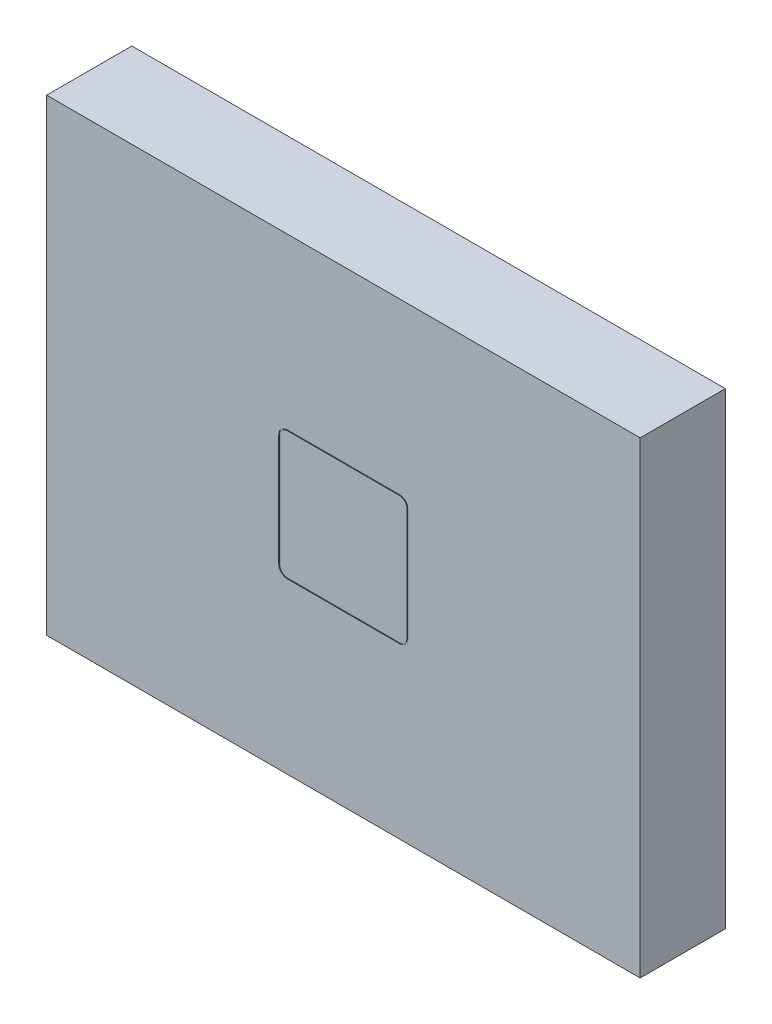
SolidWorks part; units mm, degrees
ref_plane "Front Plane" through (0, 0, 0) normal (1, 0, 0) x (0, 1, 0)
ref_plane "Top Plane" through (0, 0, 0) normal (0, 0, 1) x (0, 1, 0)
ref_plane "Right Plane" through (0, 0, 0) normal (0, 1, 0) x (-1, 0, 0)
sketch "Sketch1" plane through (0, 0, 0) normal (0, 0, 1) x (0, 1, 0)
  line L1 (-33500, 42500) -> (33500, 42500)
  line L2 (-33500, 42500) -> (-33500, -42500)
  line L3 (-33500, -42500) -> (33500, -42500)
  line L4 (33500, 42500) -> (33500, -42500)
  line L5 (-33500, 42500) -> (33500, -42500) construction
  line L6 (-33500, -42500) -> (33500, 42500) construction
  point P0 (0, 0)
  dimension "D1" = 85000
  dimension "D2" = 67000
extrude "Boss-Extrude1" add sketch "Sketch1" along normal blind 12195.2
sketch "Sketch2" plane through (0, 0, 12195.2) normal (0, 0, 1) x (1, 0, 0)
  line L1 (-8000.72, 9225) -> (8000.72, 9225)
  line L2 (-9225, 8000.72) -> (-9225, -8000.72)
  line L3 (-8000.72, -9225) -> (8000.72, -9225)
  line L4 (9225, 8000.72) -> (9225, -8000.72)
  line L5 (-9225, 9225) -> (9225, -9225) construction
  line L6 (-9225, -9225) -> (9225, 9225) construction
  arc A0 (-9225, -8000.72) -> (-8000.72, -9225) centre (-8000.72, -8000.72) ccw
  arc A1 (8000.72, -9225) -> (9225, -8000.72) centre (8000.72, -8000.72) ccw
  arc A2 (8000.72, 9225) -> (9225, 8000.72) centre (8000.72, 8000.72) cw
  arc A3 (-8000.72, 9225) -> (-9225, 8000.72) centre (-8000.72, 8000.72) ccw
  point P0 (0, 0)
  point P19 (0, -9225)
  dimension "D1" = 1224.28
  dimension "D2" = 18450
  dimension "D3" = 18450
sketch "Sketch3" plane through (0, 0, 0) normal (1, 0, 0) x (0, 1, 0)
  point P0 (-9530.7129, 12255.8637)
  dimension "D1" = 38.89
sketch_block_instance "Block1-1"
sketch_block "Block1"
sketch "Sketch4" plane through (0, 0, 12195.2) normal (0, 0, 1) x (1, 0, 0)
  line L8 (-9263.89, 8000.72) -> (-9263.89, -8000.72)
  line L9 (-8000.72, -9263.89) -> (8000.72, -9263.89)
  line L10 (9263.89, -8000.72) -> (9263.89, 8000.72)
  line L11 (8000.72, 9263.89) -> (-8000.72, 9263.89)
  line L12 (-9263.89, 8000.72) -> (-9263.89, -8000.72)
  line L13 (-8000.72, -9263.89) -> (8000.72, -9263.89)
  line L14 (9263.89, -8000.72) -> (9263.89, 8000.72)
  line L15 (8000.72, 9263.89) -> (-8000.72, 9263.89)
  line L20 (-9111.49, 8000.72) -> (-9111.49, -8000.72)
  line L21 (8000.72, 9111.49) -> (-8000.72, 9111.49)
  line L22 (9111.49, -8000.72) -> (9111.49, 8000.72)
  line L23 (-8000.72, -9111.49) -> (8000.72, -9111.49)
  line L24 (-9111.49, 8000.72) -> (-9111.49, -8000.72)
  line L25 (8000.72, 9111.49) -> (-8000.72, 9111.49)
  line L26 (9111.49, -8000.72) -> (9111.49, 8000.72)
  line L27 (-8000.72, -9111.49) -> (8000.72, -9111.49)
  arc A8 (-8000.72, 9263.89) -> (-9263.89, 8000.72) centre (-8000.72, 8000.72) ccw
  arc A9 (-9263.89, -8000.72) -> (-8000.72, -9263.89) centre (-8000.72, -8000.72) ccw
  arc A10 (8000.72, -9263.89) -> (9263.89, -8000.72) centre (8000.72, -8000.72) ccw
  arc A11 (9263.89, 8000.72) -> (8000.72, 9263.89) centre (8000.72, 8000.72) ccw
  arc A12 (-8000.72, 9263.89) -> (-9263.89, 8000.72) centre (-8000.72, 8000.72) ccw
  arc A13 (-9263.89, -8000.72) -> (-8000.72, -9263.89) centre (-8000.72, -8000.72) ccw
  arc A14 (8000.72, -9263.89) -> (9263.89, -8000.72) centre (8000.72, -8000.72) ccw
  arc A15 (9263.89, 8000.72) -> (8000.72, 9263.89) centre (8000.72, 8000.72) ccw
  arc A20 (-9111.49, -8000.72) -> (-8000.72, -9111.49) centre (-8000.72, -8000.72) ccw
  arc A21 (-8000.72, 9111.49) -> (-9111.49, 8000.72) centre (-8000.72, 8000.72) ccw
  arc A22 (9111.49, 8000.72) -> (8000.72, 9111.49) centre (8000.72, 8000.72) ccw
  arc A23 (8000.72, -9111.49) -> (9111.49, -8000.72) centre (8000.72, -8000.72) ccw
  arc A24 (-9111.49, -8000.72) -> (-8000.72, -9111.49) centre (-8000.72, -8000.72) ccw
  arc A25 (-8000.72, 9111.49) -> (-9111.49, 8000.72) centre (-8000.72, 8000.72) ccw
  arc A26 (9111.49, 8000.72) -> (8000.72, 9111.49) centre (8000.72, 8000.72) ccw
  arc A27 (8000.72, -9111.49) -> (9111.49, -8000.72) centre (8000.72, -8000.72) ccw
  dimension "D1" = 38.89
  dimension "D2" = 113.51
extrude "Cut-Extrude1" cut sketch "Sketch4" against normal blind 82.55
